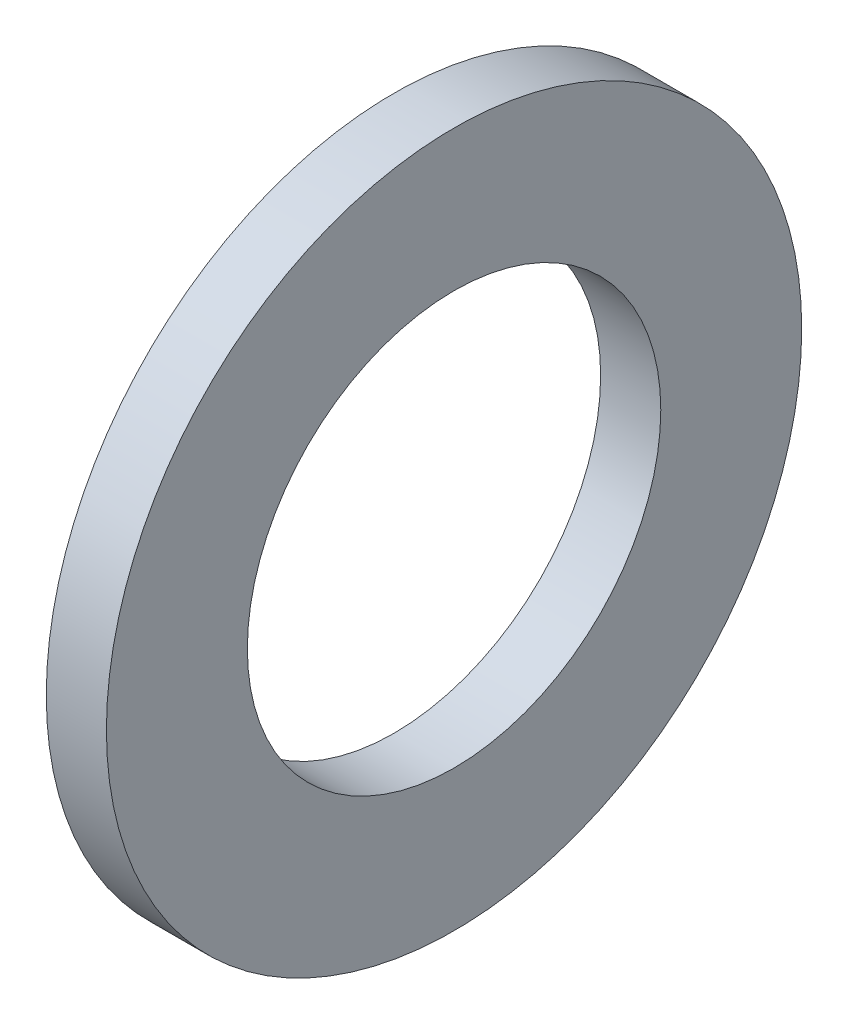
SolidWorks part; units mm, degrees
ref_plane "Plane1" through (0, 0, 0) normal (0, 0, 1) x (1, 0, 0)
ref_plane "Plane2" through (0, 0, 0) normal (0, 1, 0) x (1, 0, 0)
ref_plane "Plane3" through (0, 0, 0) normal (1, 0, 0) x (0, 0, -1)
other "Configuration Table"
sketch "Sketch1" plane through (0, 0, 0) normal (0, 0, 1) x (1, 0, 0)
  line L0 (-34.925, 0) -> (9.525, 0) construction
  line L1 (0, 11) -> (0, 18.5)
  line L2 (0, 18.5) -> (-3.2, 18.5)
  line L3 (-3.2, 18.5) -> (-3.2, 11)
  line L4 (-3.2, 11) -> (0, 11)
  dimension "Thickness" = 3.2
  dimension "Inside_dia" = 22
  dimension "Outside_dia" = 37
revolve "Base-Revolve" add sketch "Sketch1" angle 360 about L0
